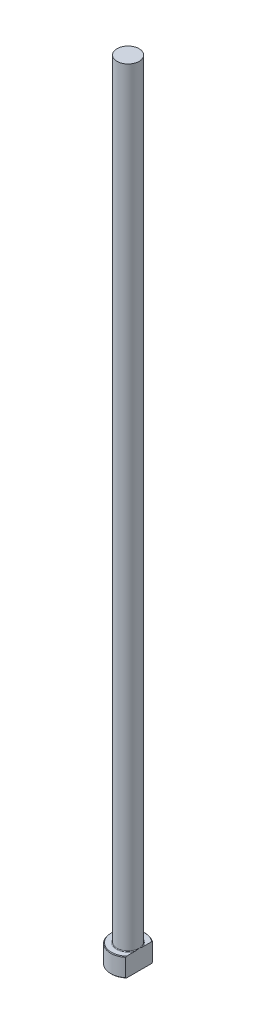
SolidWorks part; units mm, degrees
ref_plane "Front Plane" through (0, 0, 0) normal (0, 0, 1) x (1, 0, 0)
ref_plane "Top Plane" through (0, 0, 0) normal (0, 1, 0) x (1, 0, 0)
ref_plane "Right Plane" through (0, 0, 0) normal (1, 0, 0) x (0, 0, -1)
sketch "Sketch1" plane through (0, 0, 0) normal (0, 0, 1) x (1, 0, 0)
  line L0 (0, 259.9588) -> (0, -15.1925) construction
  line L1 (0, 0) -> (-5.5, 0)
  line L2 (-5.5, 0) -> (-5.5, 6)
  line L3 (-5.5, 6) -> (-3.5, 6)
  line L4 (-3.5, 6) -> (-3.5, 250)
  line L5 (-3.5, 250) -> (0, 250)
  line L6 (0, 250) -> (0, 0)
  dimension "L" = 250
  dimension "H" = 11
  dimension "T" = 6
  dimension "D" = 7
revolve "Revolve1" add sketch "Sketch1" angle 360 about L0
chamfer "Chamfer1" distance 0.2 angle 45 2 edges at (0, 6, 5.5) (0, 0, 5.5)
fillet "Fillet1" radius 0.2 1 edges at (0, 6, 3.5)
sketch "Sketch2" plane through (0, 0, 0) normal (0, 1, 0) x (1, 0, 0)
  line L0 (3.5, -4.2426) -> (3.5, 4.2426)
  circle A0 centre (0, 0) radius 5.5 construction
  arc A1 (3.5, -4.2426) -> (3.5, 4.2426) centre (0, 0) ccw
  circle A2 centre (0, 0) radius 3.5 construction
extrude "KEYED HEAD" cut sketch "Sketch2" along normal through all
